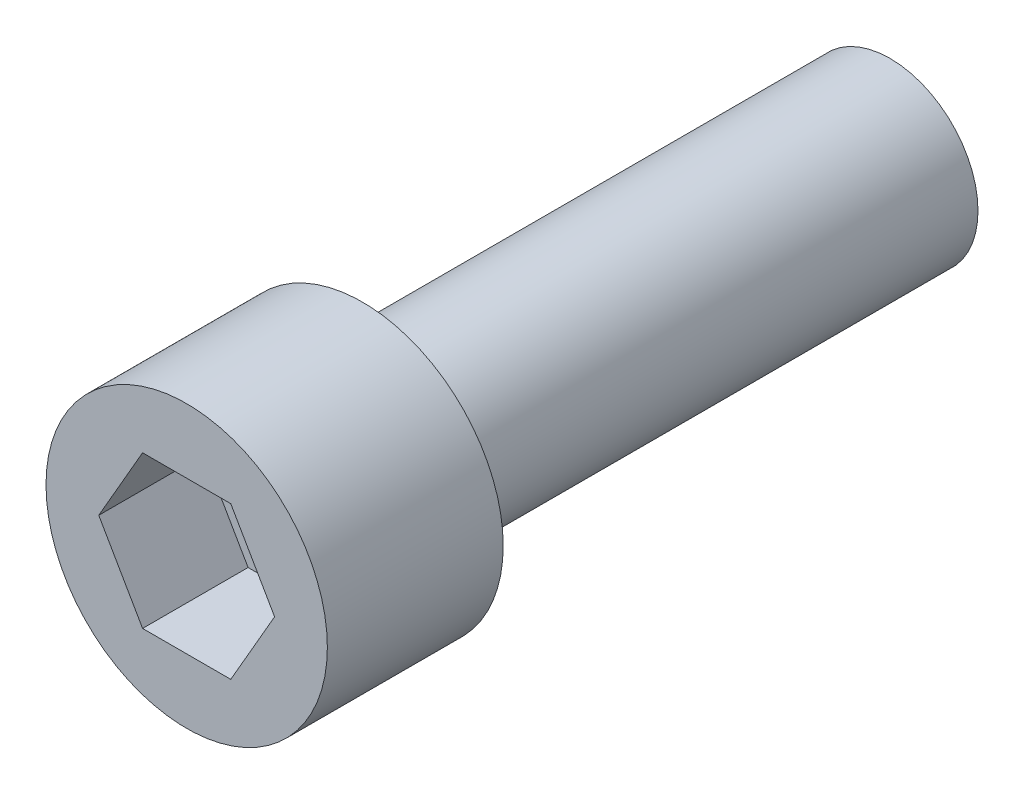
SolidWorks part; units mm, degrees
ref_plane "Plan1" through (0, 0, 0) normal (0, 0, 1) x (1, 0, 0)
ref_plane "Plan2" through (0, 0, 0) normal (0, 1, 0) x (1, 0, 0)
ref_plane "Plan3" through (0, 0, 0) normal (1, 0, 0) x (0, 0, -1)
sketch "Esquisse1" plane through (0, 0, 0) normal (0, 0, 1) x (1, 0, 0)
  circle A0 centre (0, 0) radius 4
  dimension "D1" = 8
extrude "Base-Extrusion" add sketch "Esquisse1" along normal blind 5
sketch "Esquisse3" plane through (0, 0, 5) normal (0, 0, 1) x (1, 0, 0)
  line L0 (-2.5, 0) -> (-1.2536, 2.163)
  line L1 (-1.2536, 2.163) -> (1.2536, 2.163)
  line L2 (1.2536, 2.163) -> (2.5, 0)
  line L3 (2.5, 0) -> (1.2536, -2.163)
  line L4 (1.2536, -2.163) -> (-1.2536, -2.163)
  line L5 (-1.2536, -2.163) -> (-2.5, 0)
extrude "Enlèv. mat.-Extru.1" cut sketch "Esquisse3" against normal blind 3
sketch "Esquisse4" plane through (0, 0, 0) normal (0, 0, -1) x (-1, 0, 0)
  circle A0 centre (0, 0) radius 2.5
  dimension "D1" = 5
extrude "Boss.-Extru.3" add sketch "Esquisse4" along normal blind 15
